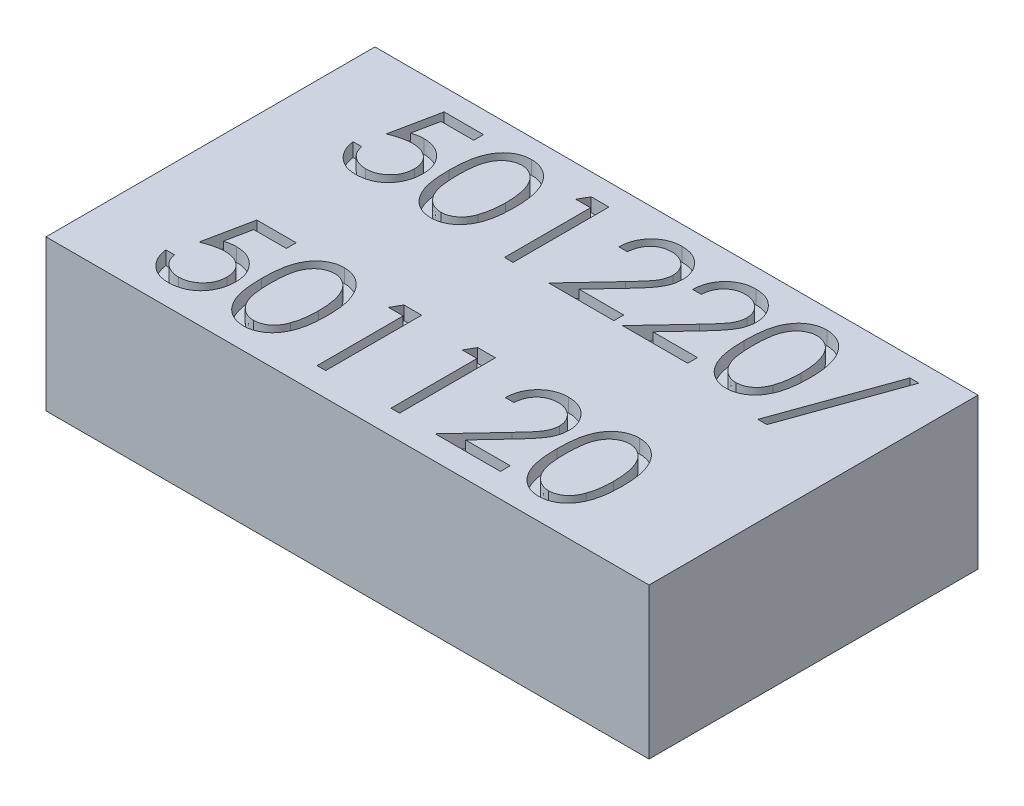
SolidWorks part; units mm, degrees
ref_plane "Front Plane" through (0, 0, 0) normal (0, 0, 1) x (1, 0, 0)
ref_plane "Top Plane" through (0, 0, 0) normal (0, 1, 0) x (1, 0, 0)
ref_plane "Right Plane" through (0, 0, 0) normal (1, 0, 0) x (0, 0, -1)
sketch "Sketch1" plane through (0, 0, 0) normal (0, 1, 0) x (1, 0, 0)
  line L1 (11, -6) -> (-11, -6)
  line L2 (11, -6) -> (11, 6)
  line L3 (11, 6) -> (-11, 6)
  line L4 (-11, -6) -> (-11, 6)
  line L5 (11, -6) -> (-11, 6) construction
  line L6 (11, 6) -> (-11, -6) construction
  point P0 (0, 0)
  point P6 (0, 0)
  dimension "D1" = 22
  dimension "D2" = 12
extrude "Boss-Extrude1" add sketch "Sketch1" along normal blind 5.5
sketch "Sketch2" plane through (0, 5.5, 0) normal (0, 1, 0) x (1, 0, 0)
  text T0 "501220/  501120"
  point P1 (-8.2497, 1.2436)
  point P2 (-8.5828, 1.7099)
extrude "Cut-Extrude1" cut sketch "Sketch2" against normal blind 0.5
equation "\"`1\"=15"
